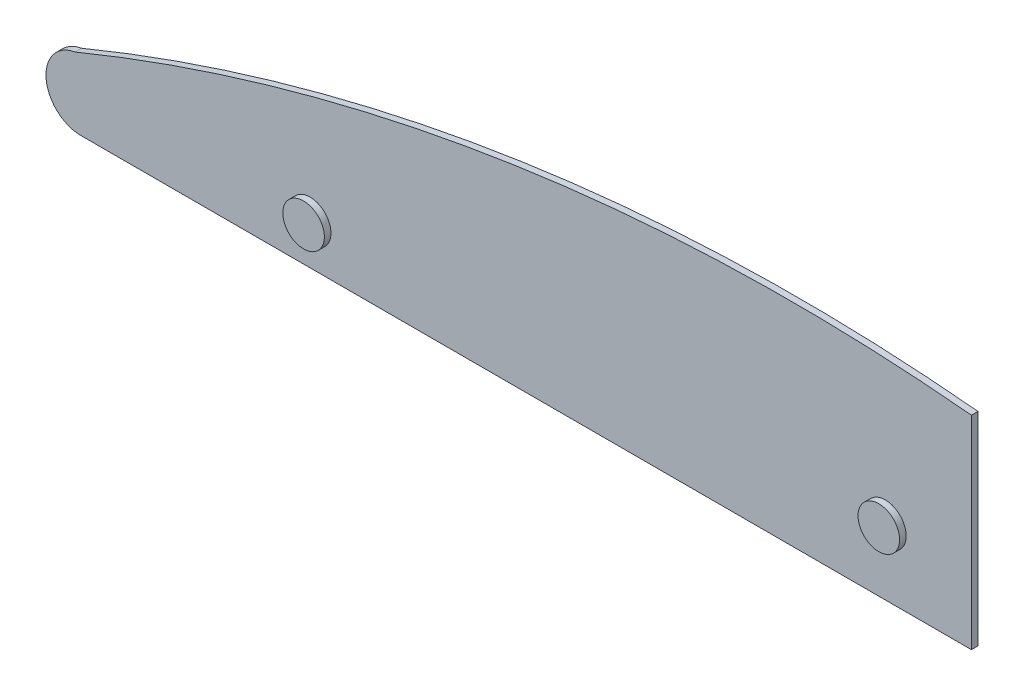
SolidWorks part; units mm, degrees
ref_plane "Front" through (0, 0, 0) normal (0, 0, 1) x (1, 0, 0)
ref_plane "Top" through (0, 0, 0) normal (0, 1, 0) x (1, 0, 0)
ref_plane "Right" through (0, 0, 0) normal (1, 0, 0) x (0, 0, -1)
sketch "Sketch1" plane through (0, 0, 0) normal (0, 0, 1) x (1, 0, 0)
  line L4 (6.35, -6.35) -> (6.35, 76.2)
  line L5 (-355.6, -6.35) -> (6.35, -6.35)
  line L6 (6.35, -6.35) -> (6.35, 76.2)
  line L7 (-355.6, -6.35) -> (6.35, -6.35)
  arc A2 (-357.9785, 21.8734) -> (-355.6, -6.35) centre (-355.6, 7.8619) ccw
  arc A3 (-357.9785, 21.8734) -> (-355.6, -6.35) centre (-355.6, 7.8619) ccw
  arc A4 (6.35, 76.2) -> (-357.9785, 21.8734) centre (-66.7637, -682.2843) ccw
  dimension "D2" = 762
  dimension "D1" = 6.35
extrude "Base-Extrude" add sketch "Sketch1" along normal blind 2.667
sketch "Sketch2" plane through (0, 0, 2.667) normal (0, 0, 1) x (1, 0, 0)
  circle A0 centre (-262.4374, 10.1041) radius 8.451
  circle A1 centre (-28.6276, 20.4331) radius 8.451
extrude "Boss-Extrude1" add sketch "Sketch2" along normal blind 2.667
